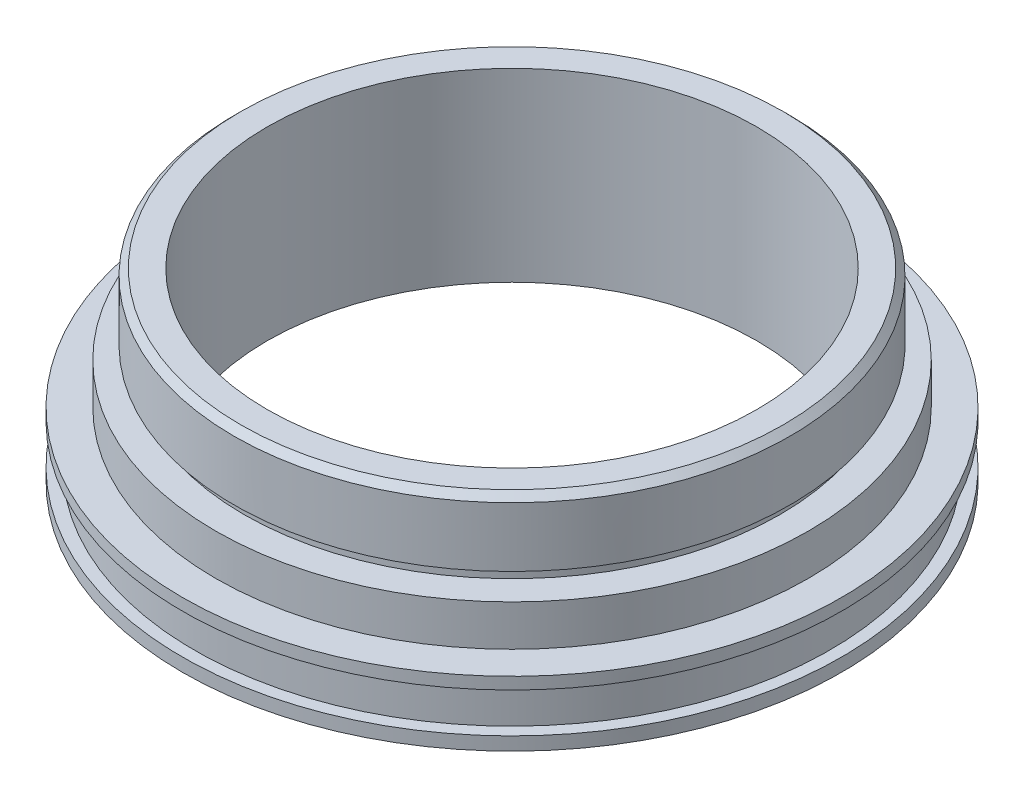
SolidWorks part; units mm, degrees
ref_plane "Front Plane" through (0, 0, 0) normal (0, 0, 1) x (1, 0, 0)
ref_plane "Top Plane" through (0, 0, 0) normal (0, 1, 0) x (1, 0, 0)
ref_plane "Right Plane" through (0, 0, 0) normal (1, 0, 0) x (0, 0, -1)
sketch "Sketch1" plane through (0, 0, 0) normal (0, 1, 0) x (1, 0, 0)
  circle A0 centre (0, 0) radius 24.9
  dimension "D1" = 49.8
extrude "Boss-Extrude1" add sketch "Sketch1" along normal blind 4.9
sketch "Sketch2" plane through (0, 4.9, 0) normal (0, 1, 0) x (1, 0, 0)
  circle A0 centre (0, 0) radius 22.4
  dimension "D1" = 44.8
extrude "Boss-Extrude2" add sketch "Sketch2" along normal blind 3.1
sketch "Sketch3" plane through (0, 8, 0) normal (0, 1, 0) x (1, 0, 0)
  circle A0 centre (0, 0) radius 21
  dimension "D1" = 42
extrude "Boss-Extrude3" add sketch "Sketch3" along normal blind 6
sketch "Sketch4" plane through (0, 14, 0) normal (0, 1, 0) x (1, 0, 0)
  circle A0 centre (0, 0) radius 18.5
  dimension "D1" = 37
extrude "Cut-Extrude1" cut sketch "Sketch4" against normal through all
sketch "Sketch5" plane through (0, 0, 0) normal (1, 0, 0) x (0, 0, -1)
  line L0 (-24.9, 4.9) -> (-24.9, 0) construction
  line L1 (-24.9, 1) -> (-24, 1)
  line L2 (-24.9, 1) -> (-24.9, 4)
  line L3 (-24.9, 4) -> (-24, 4)
  line L4 (-24, 1) -> (-24, 4)
  line L5 (0, 0) -> (0, 17.0785) construction
  line L6 (-24.9, 0) -> (24.9, 0) construction
  dimension "D1" = 0.9
  dimension "D2" = 3
  dimension "D3" = 1
revolve "Cut-Revolve1" cut sketch "Sketch5" angle 360 about L5
sketch "Sketch6" plane through (0, 0, 0) normal (1, 0, 0) x (0, 0, -1)
  line L0 (0, 0) -> (0, 18.8011) construction
  line L1 (-21, 8) -> (-20.25, 8)
  line L2 (-21, 8) -> (-21, 9)
  line L3 (-21, 9) -> (-20.25, 9)
  line L4 (-20.25, 8) -> (-20.25, 9)
  dimension "D1" = 0.75
  dimension "D2" = 1
revolve "Cut-Revolve2" cut sketch "Sketch6" angle 360 about L0
chamfer "Chamfer1" distance 0.5 angle 45 1 edges at (0, 14, 21)
